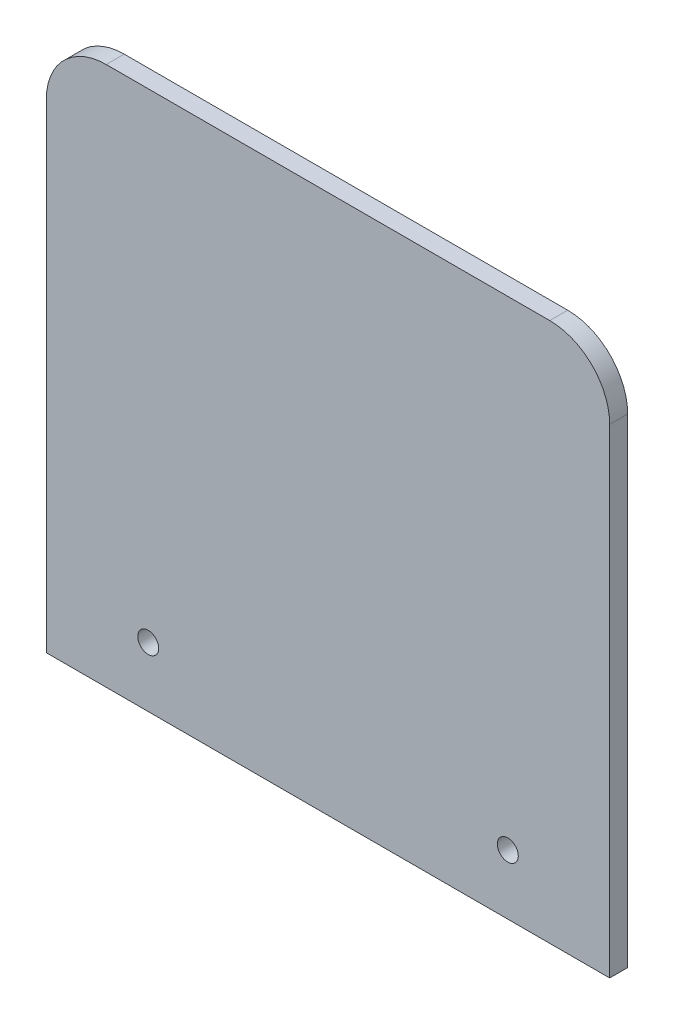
SolidWorks part; units mm, degrees
ref_plane "Front Plane" through (0, 0, 0) normal (0, 0, 1) x (1, 0, 0)
ref_plane "Top Plane" through (0, 0, 0) normal (0, 1, 0) x (1, 0, 0)
ref_plane "Right Plane" through (0, 0, 0) normal (1, 0, 0) x (0, 0, -1)
sketch "Sketch1" plane through (0, 0, 0) normal (0, 0, 1) x (1, 0, 0)
  line L0 (47, 90) -> (47, 0) construction
  line L1 (0, 0) -> (94, 0)
  line L2 (0, 0) -> (0, 80)
  line L3 (10, 90) -> (84, 90)
  line L4 (94, 0) -> (94, 80)
  line L5 (77, 10) -> (17, 10) construction
  arc A0 (94, 80) -> (84, 90) centre (84, 80) ccw
  arc A1 (0, 80) -> (10, 90) centre (10, 80) cw
  circle A2 centre (77, 10) radius 1.75
  circle A3 centre (17, 10) radius 1.75
  dimension "D1" = 10
  dimension "D2" = 17
  dimension "D3" = 17
  dimension "D4" = 3.5
  dimension "D5" = 30
  dimension "D7" = 80
  dimension "D8" = 10
extrude "Extrude1" add sketch "Sketch1" along normal blind 3
